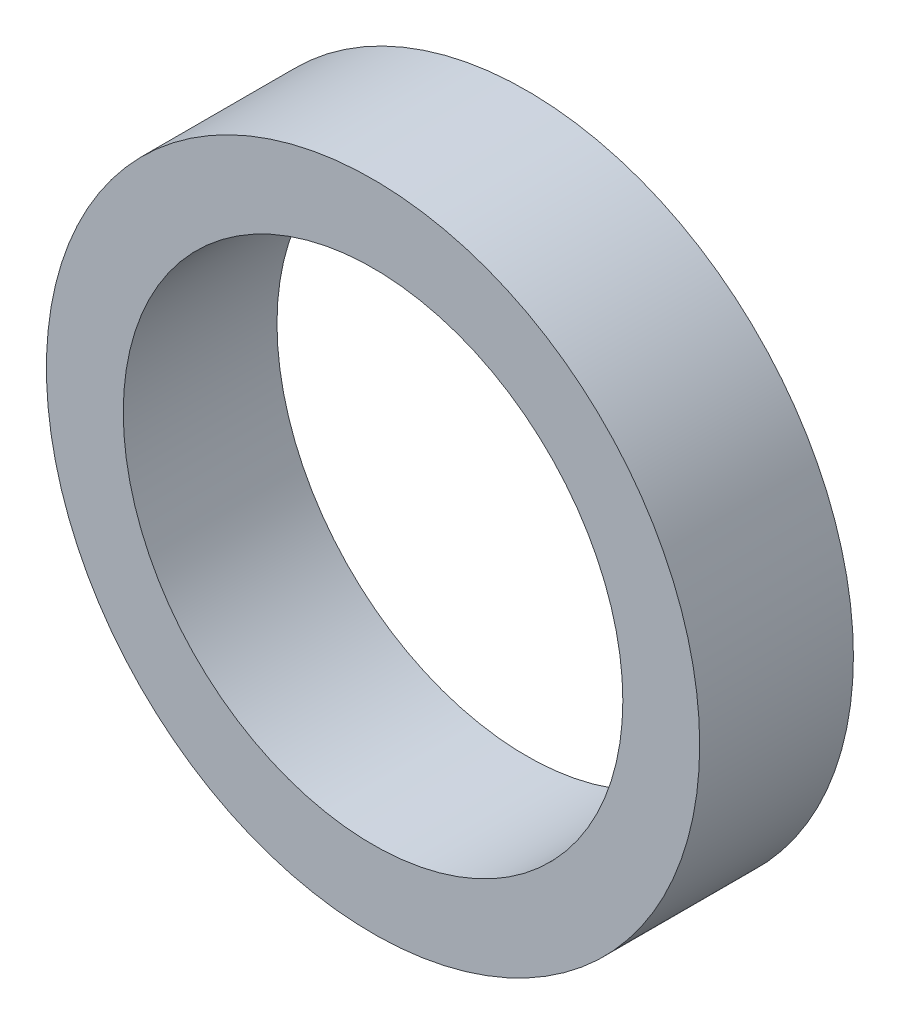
SolidWorks part; units mm, degrees
ref_plane "Front Plane" through (0, 0, 0) normal (0, 0, 1) x (1, 0, 0)
ref_plane "Top Plane" through (0, 0, 0) normal (0, 1, 0) x (1, 0, 0)
ref_plane "Right Plane" through (0, 0, 0) normal (1, 0, 0) x (0, 0, -1)
sketch "Sketch1" plane through (0, 0, 0) normal (0, 0, 1) x (1, 0, 0)
  circle A0 centre (0, 0) radius 20.6375
  circle A1 centre (0, 0) radius 26.9875
  dimension "D1" = 41.275
  dimension "D2" = 53.975
extrude "Extrude1" add sketch "Sketch1" along normal blind 12.7
